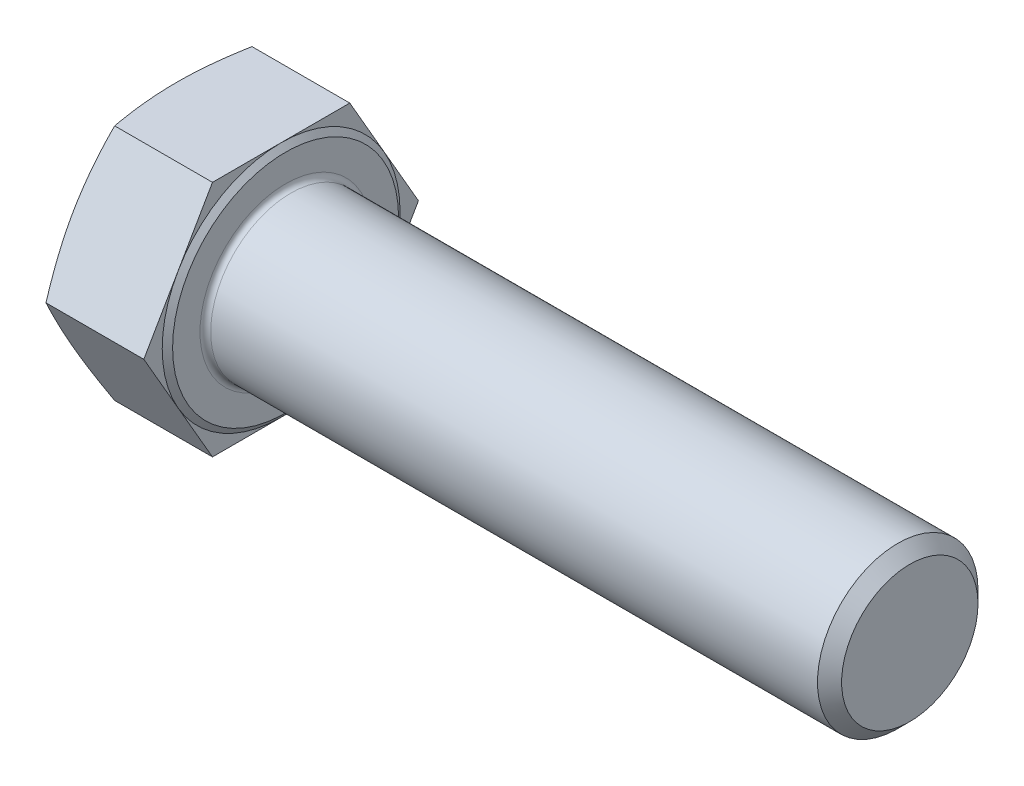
SolidWorks part; units mm, degrees
ref_plane "Front" through (0, 0, 0) normal (0, 0, 1) x (1, 0, 0)
ref_plane "Top" through (0, 0, 0) normal (0, 1, 0) x (1, 0, 0)
ref_plane "Right" through (0, 0, 0) normal (1, 0, 0) x (0, 0, -1)
sketch "Sketch-BaseHead" plane through (0, 0, 0) normal (1, 0, 0) x (0, 0, -1)
  line L1 (15.3979, 0) -> (7.699, 13.335)
  line L2 (7.699, 13.335) -> (-7.699, 13.335)
  line L3 (-7.699, 13.335) -> (-15.3979, 0)
  line L4 (-15.3979, 0) -> (-7.699, -13.335)
  line L5 (-7.699, -13.335) -> (7.699, -13.335)
  line L6 (7.699, -13.335) -> (15.3979, 0)
  circle A0 centre (0, 0) radius 13.335 construction
  dimension "s" = 26.67
extrude "BaseHead" add sketch "Sketch-BaseHead" along normal blind 11.72
sketch "Sketch4" plane through (-0.2646, 0, 5.9169) normal (0, 1, 0) x (0, 0, -1)
  line L0 (5.9169, 3.7369) -> (5.9169, -10.4477) construction
  line L2 (21.3148, -0.2646) -> (19.2519, -0.2646)
  line L4 (19.2519, -0.2646) -> (21.3148, -1.0155)
  line L6 (21.3148, -1.0155) -> (21.3148, -0.2646)
  dimension "D1" = 20
  dimension "D2" = 26.67
revolve "HeadChamfer" cut sketch "Sketch4" angle 360 about L0
sketch "Sketch1" plane through (0, 0, 0) normal (0, 0, 1) x (1, 0, 0)
  line L0 (11.72, 0) -> (12.22, 0)
  line L1 (12.22, 0) -> (12.22, -12.67)
  line L2 (12.22, -12.67) -> (11.72, -13.335)
  line L3 (11.72, -13.335) -> (11.72, 0) construction
  line L4 (0, 0) -> (7.5821, 0) construction
  line L5 (-4.0016, 0) -> (10.1831, 0) construction
  line L6 (11.72, -13.335) -> (0.7508, -13.335) construction
  line L7 (11.72, 0) -> (11.72, -13.335)
  dimension "D1" = 13.335
  dimension "c" = 0.5
  dimension "D2" = 12.67
revolve "Revolve1" add sketch "Sketch1" angle 360 about axis through (-4.0016, 0, 0) along (1, 0, 0)
ref_plane "Plane2" through (40.22, 0, 0) normal (1, 0, 0) x (0, 0, -1)
sketch "Sketch3" plane through (12.22, 0, 0) normal (1, 0, 0) x (0, 0, -1)
  circle A0 centre (0, 0) radius 9
  dimension "d" = 18
extrude "BaseBody" add sketch "Sketch3" along normal blind 70
fillet "HeadFillet" radius 0.6 1 edges at (12.22, 0, -9)
chamfer "Chamfer1" distance 1.353 angle 45 1 edges at (82.22, 0, -9)
equation "\"D1@Sketch1\" = \"s@Sketch-BaseHead\"/ 2"
equation "\"D2@Sketch4\" = \"s@Sketch-BaseHead\""
equation "\"D1@Chamfer1\" =  ( \"d@Sketch3\" - \"D2@ThreadCosmetic1\" ) / 2 "
equation "\"b@ThreadCosmetic1\" = \"l@BaseBody\" - \"lg@Plane2\""
